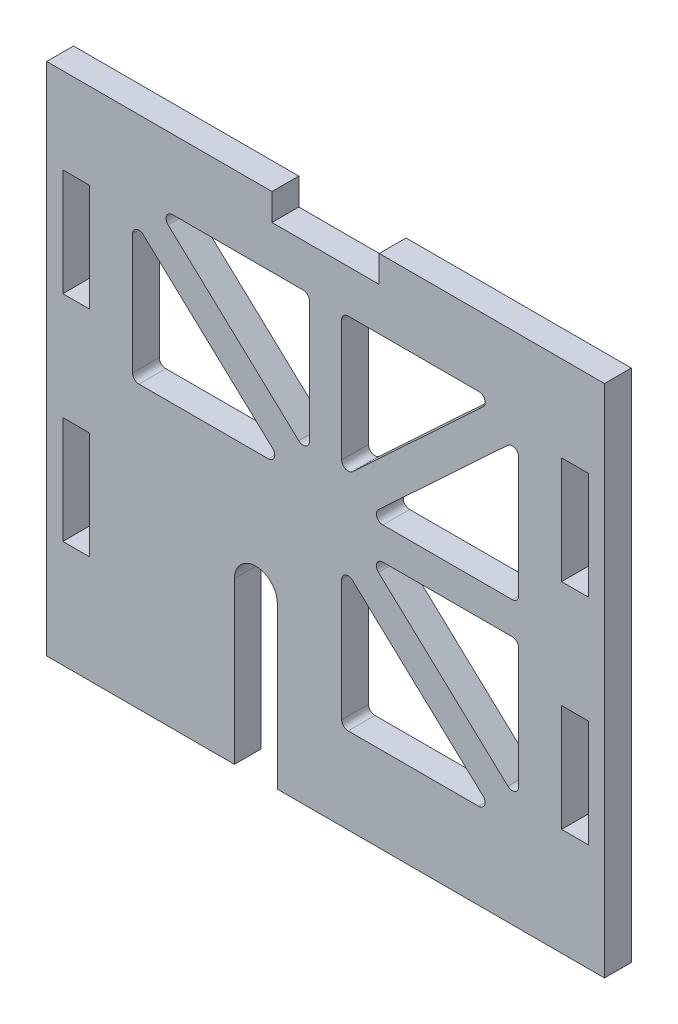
SolidWorks part; units mm, degrees
ref_plane "前视基准面" through (0, 0, 0) normal (0, 0, 1) x (1, 0, 0)
ref_plane "上视基准面" through (0, 0, 0) normal (0, 1, 0) x (1, 0, 0)
ref_plane "右视基准面" through (0, 0, 0) normal (1, 0, 0) x (0, 0, -1)
sketch "草图1" plane through (0, 0, 0) normal (0, 0, 1) x (1, 0, 0)
  line L1 (-26, 0) -> (26, 0)
  line L2 (-26, 0) -> (-26, 48)
  line L3 (-26, 48) -> (26, 48)
  line L4 (26, 0) -> (26, 48)
  dimension "D1" = 52
  dimension "D2" = 48
extrude "凸台-拉伸1" add sketch "草图1" along normal blind 2.5
sketch "草图2" plane through (0, 0, 2.5) normal (0, 0, 1) x (1, 0, 0)
  line L0 (0, 0) -> (0, 61.5244) construction
  line L1 (-26, 0) -> (26, 0) construction
  line L2 (22, 40) -> (24.5, 40)
  line L3 (22, 40) -> (22, 30)
  line L4 (22, 30) -> (24.5, 30)
  line L5 (24.5, 40) -> (24.5, 30)
  line L6 (22, 20) -> (24.5, 20)
  line L7 (22, 20) -> (22, 10)
  line L8 (22, 10) -> (24.5, 10)
  line L9 (24.5, 20) -> (24.5, 10)
  line L10 (26, 0) -> (26, 48) construction
  line L11 (-24.5, 20) -> (-24.5, 10)
  line L12 (-22, 10) -> (-24.5, 10)
  line L13 (-22, 20) -> (-22, 10)
  line L14 (-22, 20) -> (-24.5, 20)
  line L15 (-24.5, 40) -> (-24.5, 30)
  line L16 (-22, 30) -> (-24.5, 30)
  line L17 (-22, 40) -> (-22, 30)
  line L18 (-22, 40) -> (-24.5, 40)
  dimension "D1" = 10
  dimension "D2" = 10
  dimension "D3" = 10
  dimension "D4" = 2.5
  dimension "D5" = 10
  dimension "D6" = 1.5
extrude "切除-拉伸1" cut sketch "草图2" against normal up to surface (2.5 mm away)
sketch "草图3" plane through (0, 0, 0) normal (0, 0, -1) x (-1, 0, 0)
  line L0 (26, 0) -> (-26, 0) construction
  line L1 (8.5, 0) -> (4.5, 0)
  line L2 (8.5, 0) -> (8.5, 15)
  line L4 (4.5, 0) -> (4.5, 15)
  arc A0 (8.5, 15) -> (4.5, 15) centre (6.5, 15) ccw
  dimension "D2" = 2
  dimension "D3" = 15
  dimension "D1" = 6.5
extrude "切除-拉伸2" cut sketch "草图3" against normal up to surface (2.5 mm away)
sketch "草图4" plane through (0, 0, 2.5) normal (0, 0, 1) x (1, 0, 0)
  line L0 (0, 48) -> (0, 44.889) construction
  line L1 (26, 48) -> (-26, 48) construction
  line L3 (-5, 48) -> (5, 48)
  line L4 (-5, 48) -> (-5, 45.5)
  line L5 (-5, 45.5) -> (5, 45.5)
  line L6 (5, 48) -> (5, 45.5)
  dimension "D1" = 2.5
  dimension "D2" = 10
extrude "切除-拉伸3" cut sketch "草图4" against normal up to surface (2.5 mm away)
sketch "草图5" plane through (0, 0, 2.5) normal (0, 0, 1) x (1, 0, 0)
  line L0 (0, 0) -> (0, 45.5) construction
  line L1 (-5, 45.5) -> (5, 45.5) construction
  line L2 (22, 40) -> (22, 30) construction
  line L3 (-18, 8) -> (18, 8) construction
  line L4 (-18, 8) -> (-18, 41.5) construction
  line L5 (-18, 41.5) -> (18, 41.5) construction
  line L6 (18, 8) -> (18, 41.5) construction
  line L7 (-18, 8) -> (18, 41.5) construction
  line L8 (-18, 41.5) -> (18, 8) construction
  line L9 (-4.5, 0) -> (26, 0) construction
  line L10 (-18, 24.75) -> (18, 24.75) construction
  line L11 (-17.4, 26.25) -> (-5.3394, 26.25)
  line L12 (-4.9306, 27.2892) -> (-16.9913, 38.5123)
  line L13 (-18, 38.0731) -> (-18, 26.85)
  line L14 (-14.2726, 41.5) -> (-2.1, 41.5)
  line L15 (-1.5, 40.9) -> (-1.5, 29.5727)
  line L16 (-2.5087, 29.1335) -> (-14.6813, 40.4608)
  line L17 (2.5087, 29.1335) -> (14.6813, 40.4608)
  line L18 (1.5, 40.9) -> (1.5, 29.5727)
  line L19 (14.2726, 41.5) -> (2.1, 41.5)
  line L20 (14.2726, 8) -> (2.1, 8)
  line L21 (1.5, 8.6) -> (1.5, 19.9273)
  line L22 (2.5087, 20.3665) -> (14.6813, 9.0392)
  line L23 (18, 38.0731) -> (18, 26.85)
  line L24 (4.9306, 27.2892) -> (16.9913, 38.5123)
  line L25 (17.4, 26.25) -> (5.3394, 26.25)
  line L26 (18, 11.4269) -> (18, 22.65)
  line L27 (4.9306, 22.2108) -> (16.9913, 10.9877)
  line L28 (17.4, 23.25) -> (5.3394, 23.25)
  arc A0 (-14.6813, 40.4608) -> (-14.2726, 41.5) centre (-14.2726, 40.9) cw
  arc A1 (-1.5, 29.5727) -> (-2.5087, 29.1335) centre (-2.1, 29.5727) cw
  arc A2 (-2.1, 41.5) -> (-1.5, 40.9) centre (-2.1, 40.9) cw
  arc A3 (-18, 38.0731) -> (-16.9913, 38.5123) centre (-17.4, 38.0731) cw
  arc A4 (-17.4, 26.25) -> (-18, 26.85) centre (-17.4, 26.85) cw
  arc A5 (-16.9913, 38.5123) -> (-18, 38.0731) centre (-17.4, 38.0731) ccw
  arc A6 (-17.4, 26.25) -> (-18, 26.85) centre (-17.4, 26.85) cw
  arc A7 (-4.9306, 27.2892) -> (-5.3394, 26.25) centre (-5.3394, 26.85) cw
  arc A8 (2.1, 41.5) -> (1.5, 40.9) centre (2.1, 40.9) ccw
  arc A9 (1.5, 29.5727) -> (2.5087, 29.1335) centre (2.1, 29.5727) ccw
  arc A10 (14.6813, 40.4608) -> (14.2726, 41.5) centre (14.2726, 40.9) ccw
  arc A11 (14.6813, 9.0392) -> (14.2726, 8) centre (14.2726, 8.6) cw
  arc A12 (1.5, 19.9273) -> (2.5087, 20.3665) centre (2.1, 19.9273) cw
  arc A13 (2.1, 8) -> (1.5, 8.6) centre (2.1, 8.6) cw
  arc A14 (4.9306, 27.2892) -> (5.3394, 26.25) centre (5.3394, 26.85) ccw
  arc A15 (17.4, 26.25) -> (18, 26.85) centre (17.4, 26.85) ccw
  arc A16 (16.9913, 38.5123) -> (18, 38.0731) centre (17.4, 38.0731) cw
  arc A17 (17.4, 26.25) -> (18, 26.85) centre (17.4, 26.85) ccw
  arc A18 (18, 38.0731) -> (16.9913, 38.5123) centre (17.4, 38.0731) ccw
  arc A19 (16.9913, 10.9877) -> (18, 11.4269) centre (17.4, 11.4269) ccw
  arc A20 (17.4, 23.25) -> (18, 22.65) centre (17.4, 22.65) cw
  arc A21 (4.9306, 22.2108) -> (5.3394, 23.25) centre (5.3394, 22.65) cw
  point P5 (0, 24.75)
  point P24 (-15.7981, 41.5)
  point P29 (-1.5, 41.5)
  point P32 (-18, 39.451)
  point P35 (-18, 26.25)
  point P53 (1.5, 41.5)
  point P54 (15.7981, 41.5)
  point P64 (15.7981, 8)
  point P65 (1.5, 8)
  point P75 (18, 26.25)
  point P76 (18, 39.451)
  dimension "D4" = 0.6
  dimension "D5" = 0.6
  dimension "D6" = 0.6
  dimension "D7" = 0.6
  dimension "D8" = 0.6
  dimension "D9" = 1.5
  dimension "D10" = 0.6
  dimension "D1" = 4
  dimension "D2" = 4
  dimension "D3" = 8
  dimension "D11" = 1.5
  dimension "D12" = 1.5
  dimension "D13" = 1.5
extrude "切除-拉伸5" cut sketch "草图5" against normal blind 10 contours A2 L14 A0 L16 A1 L15 | L17 A10 L19 A8 L18 A9 | A21 L27 A19 L26 A20 L28 | A13 L20 A11 L22 A12 L21 | A16 L24 A14 L25 A15 L23 | L12 A5 L13 A6 L11 A7
